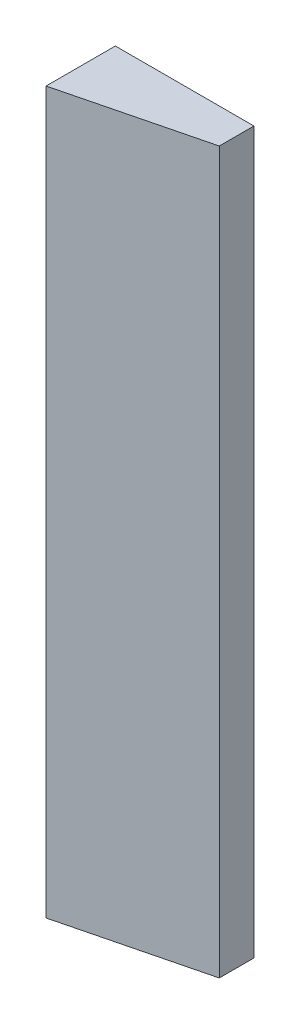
SolidWorks part; units mm, degrees
ref_plane "Front Plane" through (0, 0, 0) normal (1, 0, 0) x (0, 1, 0)
ref_plane "Top Plane" through (0, 0, 0) normal (0, 0, 1) x (0, 1, 0)
ref_plane "Right Plane" through (0, 0, 0) normal (0, 1, 0) x (-1, 0, 0)
sketch "Sketch1" plane through (0, 0, 0) normal (1, 0, 0) x (0, 1, 0)
  line L0 (-165.1, -158.75) -> (165.1, -158.75)
  line L1 (165.1, -158.75) -> (165.1, -127)
  line L2 (165.1, -127) -> (-165.1, -127)
  line L3 (-165.1, -127) -> (-165.1, -158.75)
ref_plane "Plane1" through (63.5, 0, 0) normal (1, 0, 0) x (0, 1, 0)
sketch "Sketch2" plane through (63.5, 0, 0) normal (1, 0, 0) x (0, 1, 0)
  line L0 (-165.1, -158.75) -> (165.1, -158.75)
  line L1 (165.1, -158.75) -> (165.1, -142.875)
  line L2 (165.1, -142.875) -> (-165.1, -142.875)
  line L3 (-165.1, -142.875) -> (-165.1, -158.75)
loft "Sloping_support_face" add profiles "Sketch1", "Sketch2"
